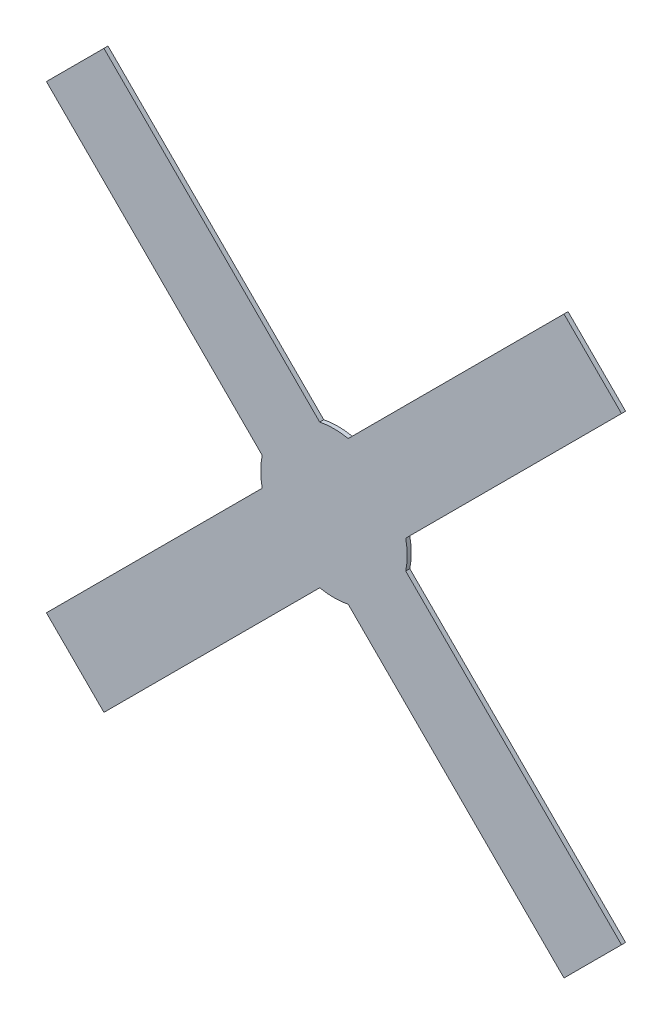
SolidWorks part; units mm, degrees
ref_plane "Plan de face" through (0, 0, 0) normal (0, 0, 1) x (1, 0, 0)
ref_plane "Plan de dessus" through (0, 0, 0) normal (0, 1, 0) x (1, 0, 0)
ref_plane "Plan de droite" through (0, 0, 0) normal (1, 0, 0) x (0, 0, -1)
sketch "Esquisse1" plane through (0, 0, 0) normal (0, 0, 1) x (1, 0, 0)
  line L0 (0, 0) -> (-318.1981, 318.1981) construction
  line L1 (0, 0) -> (0, 100.4066) construction
  line L2 (-88.2704, 17.5597) -> (-353.5534, 282.8427)
  line L3 (-353.5534, 282.8427) -> (-282.8427, 353.5534)
  line L4 (-282.8427, 353.5534) -> (-17.5597, 88.2704)
  line L5 (17.5597, 88.2704) -> (282.8427, 353.5534)
  line L6 (282.8427, 353.5534) -> (353.5534, 282.8427)
  line L7 (353.5534, 282.8427) -> (88.2704, 17.5597)
  line L8 (88.2704, -17.5597) -> (353.5534, -282.8427)
  line L9 (353.5534, -282.8427) -> (282.8427, -353.5534)
  line L10 (282.8427, -353.5534) -> (17.5597, -88.2704)
  line L11 (-17.5597, -88.2704) -> (-282.8427, -353.5534)
  line L12 (-282.8427, -353.5534) -> (-353.5534, -282.8427)
  line L13 (-353.5534, -282.8427) -> (-88.2704, -17.5597)
  arc A0 (-88.2704, 17.5597) -> (-88.2704, -17.5597) centre (0, 0) ccw
  arc A1 (17.5597, 88.2704) -> (-17.5597, 88.2704) centre (0, 0) ccw
  arc A2 (-17.5597, -88.2704) -> (17.5597, -88.2704) centre (0, 0) ccw
  arc A3 (88.2704, -17.5597) -> (88.2704, 17.5597) centre (0, 0) ccw
  point P23 (0, 0)
  dimension "D2" = 180
  dimension "D3" = 450
  dimension "D1" = 45
  dimension "D4" = 100
  dimension "D5" = 4
extrude "Boss.-Extru.1" add sketch "Esquisse1" along normal blind 5
